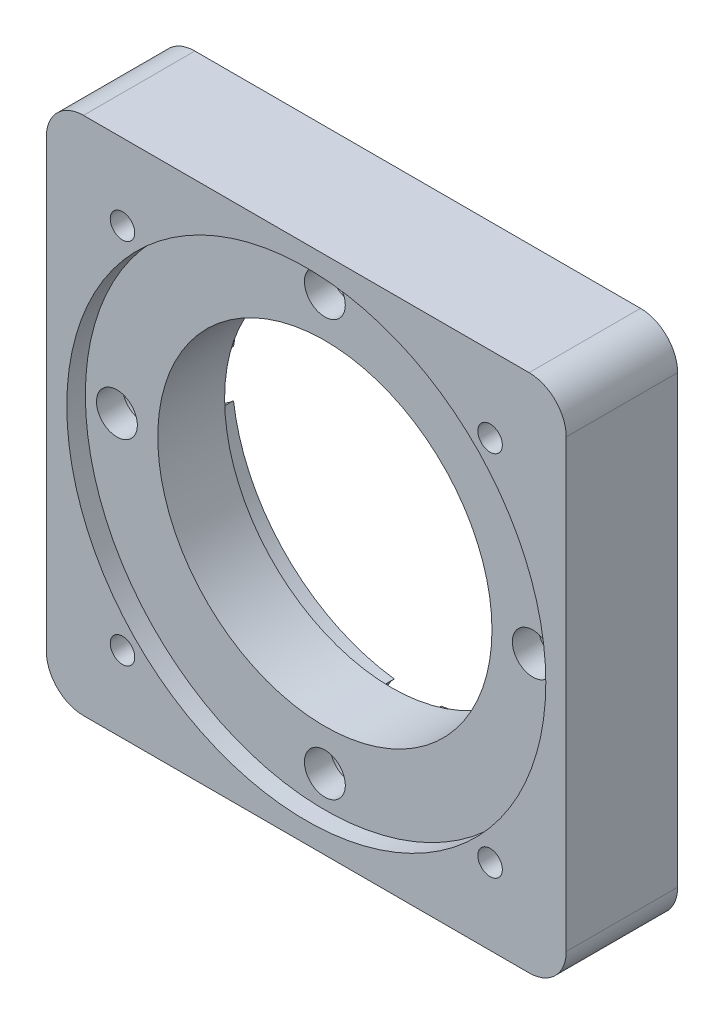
SolidWorks part; units mm, degrees
ref_plane "前视基准面" through (0, 0, 0) normal (0, 0, 1) x (1, 0, 0)
ref_plane "上视基准面" through (0, 0, 0) normal (0, 1, 0) x (1, 0, 0)
ref_plane "右视基准面" through (0, 0, 0) normal (1, 0, 0) x (0, 0, -1)
sketch "草图1" plane through (0, 0, 0) normal (0, 0, 1) x (1, 0, 0)
  line L1 (-30, -35) -> (30, -35)
  line L2 (-35, -30) -> (-35, 30)
  line L3 (-30, 35) -> (30, 35)
  line L4 (35, -30) -> (35, 30)
  line L5 (-35, -35) -> (35, 35) construction
  line L6 (-35, 35) -> (35, -35) construction
  arc A0 (35, -30) -> (30, -35) centre (30, -30) cw
  arc A1 (-30, -35) -> (-35, -30) centre (-30, -30) cw
  arc A2 (35, 30) -> (30, 35) centre (30, 30) ccw
  arc A3 (-35, 30) -> (-30, 35) centre (-30, 30) cw
  point P0 (0, 0)
  dimension "D3" = 5
  dimension "D1" = 70
  dimension "D2" = 70
extrude "凸台-拉伸1" add sketch "草图1" along normal blind 15
sketch "草图2" plane through (0, 0, 15) normal (0, 0, 1) x (1, 0, 0)
  circle A0 centre (0, 0) radius 32.25
  dimension "D1" = 64.5
extrude "切除-拉伸1" cut sketch "草图2" against normal blind 2.5
sketch "草图3" plane through (0, 0, 12.5) normal (0, 0, 1) x (1, 0, 0)
  circle A0 centre (0, 0) radius 28 construction
  circle A1 centre (0, 28) radius 2.75
  dimension "D1" = 56
  dimension "D2" = 5.5
extrude "切除-拉伸2" cut sketch "草图3" against normal blind 12.5
sketch "草图4" plane through (0, 0, 0) normal (0, 0, -1) x (-1, 0, 0)
  circle A0 centre (0, 28) radius 4.5
  dimension "D1" = 9
extrude "切除-拉伸3" cut sketch "草图4" against normal blind 9
pattern_circular "阵列(圆周)1" count 4 over 360 about axis through (0, 0, 0) along (0, 0, 1) of "切除-拉伸2", "切除-拉伸3"
sketch "草图5" plane through (0, 0, 0) normal (0, 0, -1) x (-1, 0, 0)
  circle A0 centre (0, 0) radius 25
  dimension "D1" = 50
extrude "切除-拉伸4" cut sketch "草图5" against normal blind 3.5
sketch "草图6" plane through (0, 0, 12.5) normal (0, 0, 1) x (1, 0, 0)
  circle A0 centre (0, 0) radius 22.5
  dimension "D1" = 45
extrude "切除-拉伸5" cut sketch "草图6" against normal blind 13.5
sketch "草图7" plane through (0, 0, 0) normal (0, 0, -1) x (-1, 0, 0)
  line L0 (35, 0) -> (0, 0) construction
  line L1 (0, 0) -> (24.7487, 24.7487) construction
  circle A0 centre (0, 0) radius 35 construction
  dimension "D1" = 70
  dimension "D2" = 45
hole_wizard "M4 螺纹孔1" positions "3D草图1" profile "草图8" tap size "M4" standard "Iso"
sketch3d "3D草图1"
  point P0 (-24.7487, 24.7487, 0)
sketch "草图8" plane through (-24.7487, 24.7487, 0) normal (1, 0, 0) x (0, 1, 0)
  line L0 (0, 0) -> (0, 15)
  line L1 (0, 15) -> (1.65, 15)
  line L2 (1.65, 15) -> (1.65, 0)
  line L5 (1.65, 0) -> (0, 0)
  line L11 (0, -6.35) -> (0, 107.95) construction
  dimension "通孔螺纹孔钻头直径" = 3.3
  dimension "通孔螺纹孔钻头深度" = 15
pattern_circular "阵列(圆周)2" count 4 over 360 about axis through (0, 0, 0) along (0, 0, 1) of "M4 螺纹孔1"
